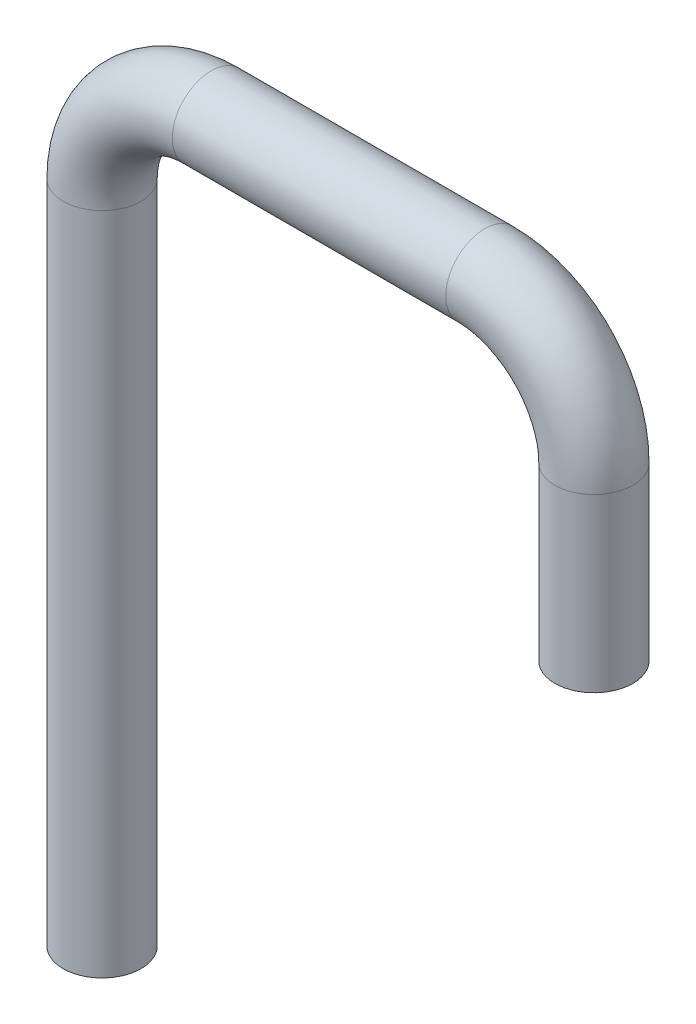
SolidWorks part; units mm, degrees
ref_plane "Front Plane" through (0, 0, 0) normal (0, 0, 1) x (1, 0, 0)
ref_plane "Top Plane" through (0, 0, 0) normal (0, 1, 0) x (1, 0, 0)
ref_plane "Right Plane" through (0, 0, 0) normal (1, 0, 0) x (0, 0, -1)
sketch "Sketch1" plane through (0, 0, 0) normal (0, 0, 1) x (1, 0, 0)
  line L0 (0, 0) -> (0, 54.102)
  line L1 (8.89, 62.992) -> (31.1537, 62.992)
  line L2 (40.0437, 54.102) -> (40.0437, 40.132)
  arc A0 (8.89, 62.992) -> (0, 54.102) centre (8.89, 54.102) ccw
  arc A1 (40.0437, 54.102) -> (31.1537, 62.992) centre (31.1537, 54.102) ccw
  dimension "D3" = 8.89
  dimension "D1" = 40.132
  dimension "D2" = 56.6928
  dimension "D4" = 13.97
sketch "Sketch2" plane through (0, 0, 0) normal (0, 1, 0) x (1, 0, 0)
  circle A0 centre (0, 0) radius 2.286
  dimension "D1" = 4.572
sweep "Sweep-Thin1" add profiles "Sketch2" path "Sketch1" parameters "D1"=0.889
